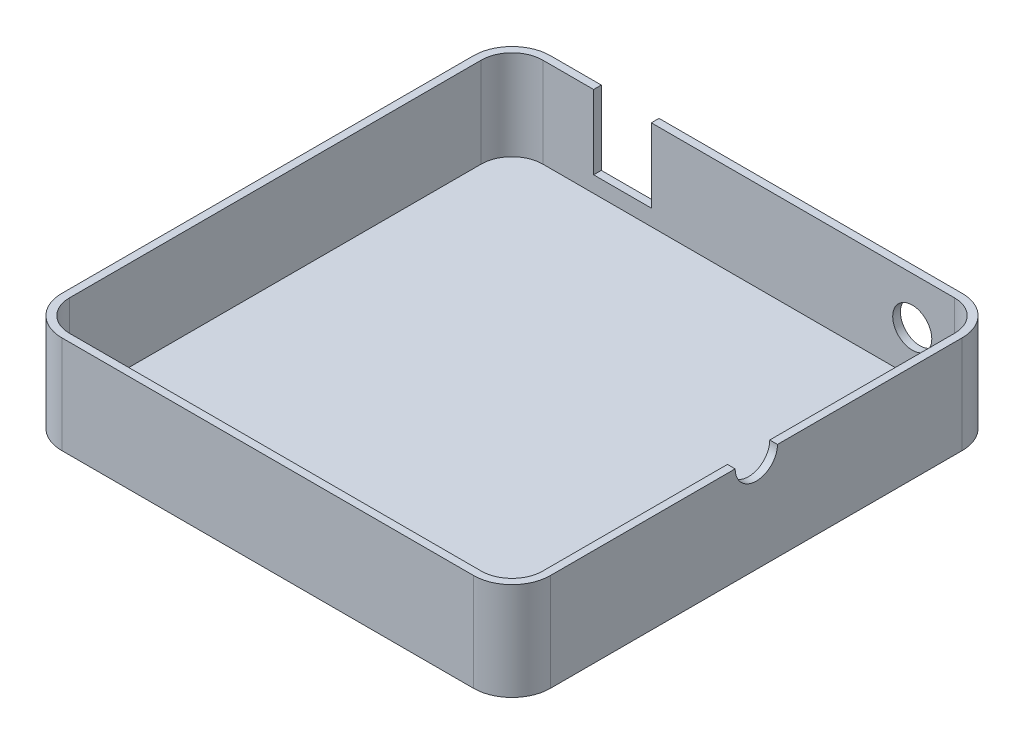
SolidWorks part; units mm, degrees
ref_plane "Front" through (0, 0, 0) normal (0, 0, 1) x (1, 0, 0)
ref_plane "Top" through (0, 0, 0) normal (0, 1, 0) x (1, 0, 0)
ref_plane "Right" through (0, 0, 0) normal (1, 0, 0) x (0, 0, -1)
sketch "Sketch1" plane through (0, 0, 0) normal (0, 0, 1) x (1, 0, 0)
  line L1 (0, 0) -> (127, 0)
  line L2 (0, 0) -> (0, -25.4)
  line L3 (0, -25.4) -> (127, -25.4)
  line L4 (127, 0) -> (127, -25.4)
  dimension "D1" = 127
  dimension "D2" = 25.4
extrude "Boss-Extrude1" add sketch "Sketch1" along normal blind 127
fillet "Fillet1" radius 10 4 edges at (0, -12.7, 127) (127, -12.7, 127) (127, -12.7, 0) (0, -12.7, 0)
shell "Shell2" thickness 2
sketch "Sketch3" plane through (127, 0, 0) normal (1, 0, 0) x (0, 0, -1)
  line L0 (-117, 0) -> (-10, 0) construction
  circle A0 centre (-63.5, 0) radius 5.5
extrude "Boss-Extrude2" add sketch "Sketch3" along normal blind 4
sketch "Sketch6" plane through (0, 0, 0) normal (0, 0, -1) x (-1, 0, 0)
  circle A0 centre (-106.0257, -12.2005) radius 5.08
extrude "Cut-Extrude1" cut sketch "Sketch6" against normal blind 4
sketch "Sketch7" plane through (0, 0, 0) normal (-1, 0, 0) x (0, 0, 1)
  circle A0 centre (28.6254, -12.7181) radius 6
  circle A1 centre (55.076, -12.7181) radius 6
  circle A2 centre (84.992, -12.7181) radius 6
  dimension "D1" = 12
  dimension "D2" = 12
  dimension "D3" = 12
extrude "Boss-Extrude3" add sketch "Sketch7" along normal blind 2
sketch "Sketch8" plane through (0, 0, 0) normal (0, 0, -1) x (-1, 0, 0)
  line L1 (-38.2148, -19.2075) -> (-23.2148, -19.2075)
  line L2 (-38.2148, -19.2075) -> (-38.2148, 15.7925)
  line L3 (-38.2148, 15.7925) -> (-23.2148, 15.7925)
  line L4 (-23.2148, -19.2075) -> (-23.2148, 15.7925)
extrude "Cut-Extrude2" cut sketch "Sketch8" against normal up to next
